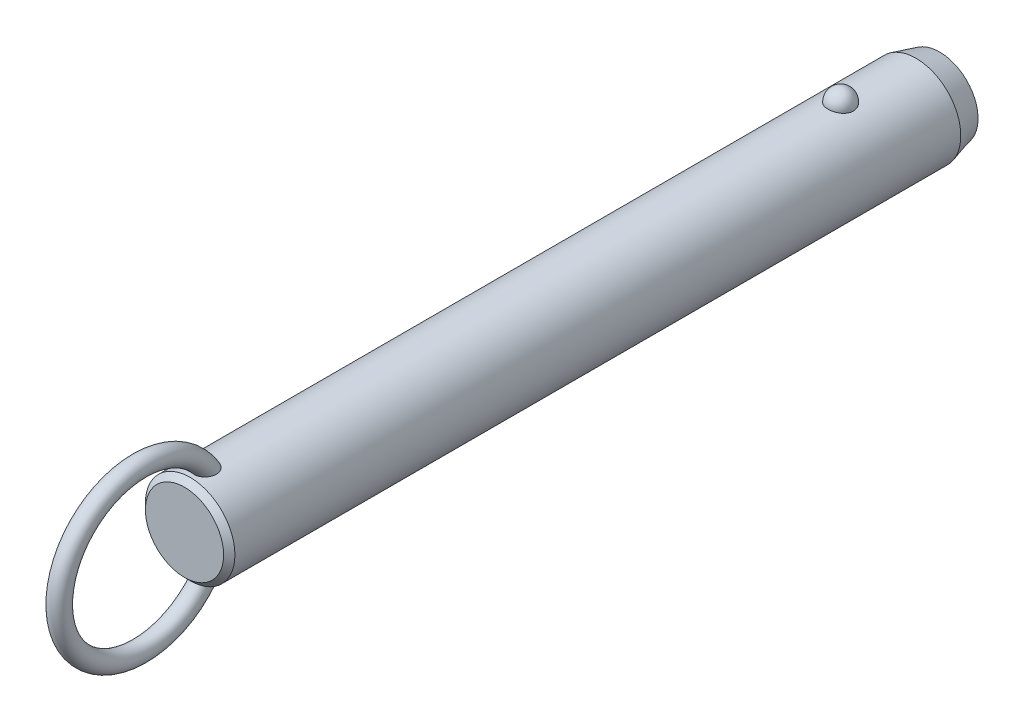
SolidWorks part; units mm, degrees
ref_plane "Front Plane" through (0, 0, 0) normal (0, 0, 1) x (1, 0, 0)
ref_plane "Top Plane" through (0, 0, 0) normal (0, 1, 0) x (1, 0, 0)
ref_plane "Right Plane" through (0, 0, 0) normal (1, 0, 0) x (0, 0, -1)
sketch "Sketch2" plane through (0, 0, 0) normal (0, 0, 1) x (1, 0, 0)
  circle A0 centre (0, 0) radius 9.5
  point P3 (0, 9.5)
  dimension "D1" = 19
extrude "Boss-Extrude1" add sketch "Sketch2" along normal blind 127
sketch "Sketch3" plane through (0, 0, 0) normal (0, 0, -1) x (-1, 0, 0)
  circle A0 centre (0, 0) radius 9.5
  dimension "D1" = 19
extrude "Boss-Extrude2" add sketch "Sketch3" along normal blind 23.7
chamfer "Chamfer1" distance 5 angle 15 1 edges at (-9.5, 0, -23.7)
sketch "Sketch12" plane through (0, 0, 0) normal (1, 0, 0) x (0, 0, -1)
  line L0 (-127, 9.5) -> (-127, -9.5) construction
  point P0 (-127, 0)
sketch "Sketch13" plane through (0, 0, 0) normal (1, 0, 0) x (0, 0, -1)
  circle A0 centre (-146.05, 0) radius 19.05
  point P2 (-127, 0)
  dimension "D1" = 38.1
sketch "Sketch14" plane through (0, 0, 0) normal (0, 1, 0) x (1, 0, 0)
  circle A0 centre (0, -129) radius 2
  point P2 (0, -127)
  dimension "D1" = 4
sweep "Sweep1" add profiles "Sketch14" path "Sketch13"
sketch "Sketch15" plane through (0, 0, 127) normal (0, 0, 1) x (1, 0, 0)
  circle A0 centre (0, 0) radius 9.5
  dimension "D1" = 19
extrude "Boss-Extrude3" add sketch "Sketch15" along normal blind 9.52
chamfer "Chamfer2" distance 1.2 angle 45 1 edges at (9.5, 0, 136.52)
sketch "Sketch18" plane through (0, 0, 0) normal (1, 0, 0) x (0, 0, -1)
  line L0 (18.7, 9.5) -> (-129.5378, 9.5) construction
  line L1 (2.7, 12.2) -> (2.7, 6.8)
  line L2 (-129.5378, -9.5) -> (18.7, -9.5) construction
  arc A0 (2.7, 12.2) -> (2.7, 6.8) centre (2.7, 9.5) ccw
  point P4 (0, 9.5)
  dimension "D1" = 21.7
revolve "Revolve1" add sketch "Sketch18" angle 360 about L1
